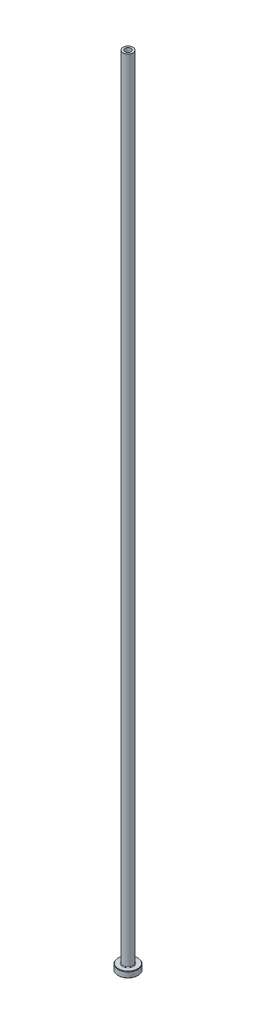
SolidWorks part; units mm, degrees
ref_plane "Front Plane" through (0, 0, 0) normal (0, 0, 1) x (1, 0, 0)
ref_plane "Top Plane" through (0, 0, 0) normal (0, 1, 0) x (1, 0, 0)
ref_plane "Right Plane" through (0, 0, 0) normal (1, 0, 0) x (0, 0, -1)
sketch "Sketch1" plane through (0, 0, 0) normal (0, 0, 1) x (1, 0, 0)
  line L0 (-1.5, 400) -> (-2.5, 400)
  line L1 (-2.5, 400) -> (-2.5, 3)
  line L2 (-2.5, 3) -> (-5, 3)
  line L3 (-5, 3) -> (-5, 0)
  line L4 (5.5, 0) -> (-5.5, 0) construction
  line L5 (-5, 0) -> (-1.75, 0)
  line L6 (-1.5, 355) -> (-1.5, 400)
  line L7 (0, 92.1877) -> (0, -15.5353) construction
  line L8 (0, -5.5) -> (0, 5.5) construction
  line L9 (-1.5, 355) -> (-1.75, 343)
  line L10 (-1.75, 343) -> (-1.75, 0)
  dimension "D1" = 0.25
  dimension "ID" = 3
  dimension "OD" = 5
  dimension "L" = 400
  dimension "H" = 10
  dimension "T" = 3
  dimension "N" = 45
  dimension "D2" = 12
revolve "Revolve1" add sketch "Sketch1" angle 360 about L7
fillet "Fillet1" radius 0.3 1 edges at (0, 3, 2.5)
chamfer "Chamfer1" distance 0.2 angle 45 2 edges at (0, 3, 5) (0, 0, 5)
chamfer "Chamfer3" distance 0.5 angle 45 1 edges at (0, 0, 1.75)
